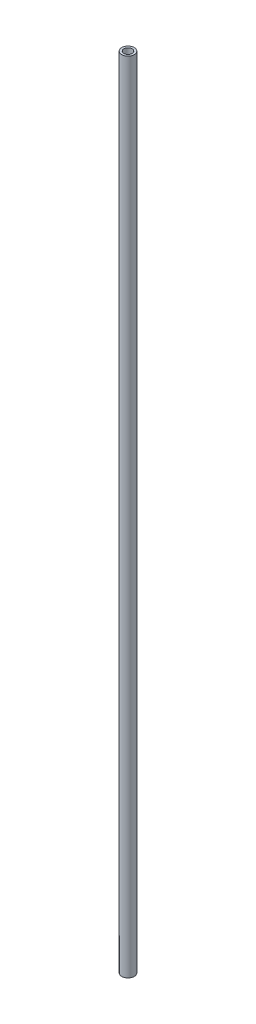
SolidWorks part; units mm, degrees
ref_plane "Front Plane" through (0, 0, 0) normal (0, 0, 1) x (1, 0, 0)
ref_plane "Top Plane" through (0, 0, 0) normal (0, 1, 0) x (1, 0, 0)
ref_plane "Right Plane" through (0, 0, 0) normal (1, 0, 0) x (0, 0, -1)
sketch "Sketch1" plane through (0, 0, 0) normal (0, 1, 0) x (1, 0, 0)
  circle A0 centre (0, 0) radius 1.5621
  circle A1 centre (0, 0) radius 2.3813
  dimension "D1" = 4.7625
  dimension "D2" = 3.1242
extrude "Boss-Extrude1" add sketch "Sketch1" along normal blind 304.8
